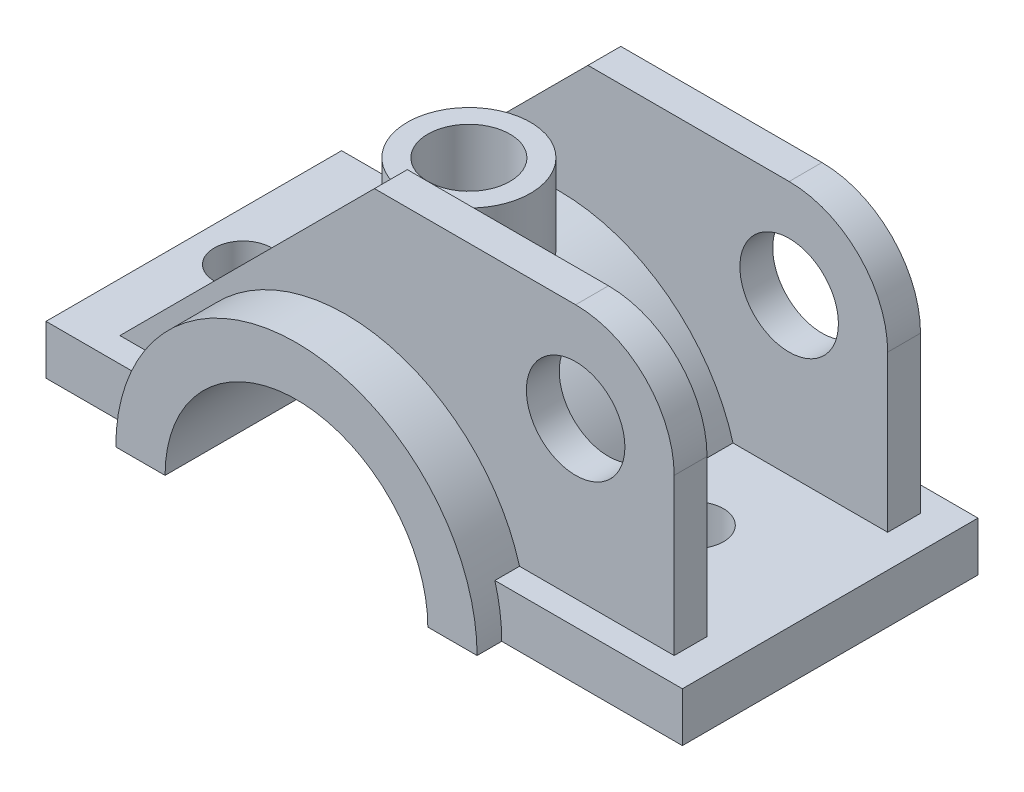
SolidWorks part; units mm, degrees
ref_plane "前视基准面" through (0, 0, 0) normal (0, 0, 1) x (1, 0, 0)
ref_plane "上视基准面" through (0, 0, 0) normal (0, 1, 0) x (1, 0, 0)
ref_plane "右视基准面" through (0, 0, 0) normal (1, 0, 0) x (0, 0, -1)
sketch "草图1" plane through (0, 0, 0) normal (0, 0, 1) x (1, 0, 0)
  line L0 (-44, 0) -> (-32, 0)
  line L1 (32, 0) -> (44, 0)
  arc A0 (32, 0) -> (-32, 0) centre (0, 0) ccw
  arc A1 (44, 0) -> (-44, 0) centre (0, 0) ccw
extrude "拉伸1" add sketch "草图1" against normal mid plane 84
ref_plane "基准面1" through (-67, 0, 0) normal (1, 0, 0) x (0, 0, -1)
sketch "草图2" plane through (-67, 0, 0) normal (1, 0, 0) x (0, 0, -1)
  line L1 (0, 0) -> (0, 59.652) construction
  line L2 (42, 0) -> (-42, 0) construction
  line L4 (-36, 12) -> (36, 12)
  line L5 (-36, 12) -> (-36, 0)
  line L6 (-36, 0) -> (36, 0)
  line L7 (36, 12) -> (36, 0)
extrude "拉伸2" add sketch "草图2" along normal up to next
ref_plane "基准面2" through (88, 0, 0) normal (1, 0, 0) x (0, 0, -1)
sketch "草图3" plane through (88, 0, 0) normal (1, 0, 0) x (0, 0, -1)
  line L1 (-36, 12) -> (36, 12)
  line L2 (-36, 12) -> (-36, 0)
  line L3 (-36, 0) -> (36, 0)
  line L4 (36, 12) -> (36, 0)
extrude "拉伸3" add sketch "草图3" against normal up to next
ref_plane "基准面3" through (0, 62, 0) normal (0, 1, 0) x (-1, 0, 0)
sketch "草图4" plane through (0, 62, 0) normal (0, 1, 0) x (-1, 0, 0)
  circle A0 centre (0, 0) radius 10
  circle A1 centre (0, 0) radius 15
extrude "拉伸4" add sketch "草图4" against normal up to next
ref_plane "基准面4" through (0, 0, 30) normal (0, 0, 1) x (1, 0, 0)
sketch "草图6" plane through (0, 0, 30) normal (0, 0, 1) x (1, 0, 0)
  line L0 (80, 12) -> (80, 50)
  line L1 (42.332, 12) -> (88, 12) construction
  line L2 (56, 74) -> (7, 74)
  line L3 (7, 74) -> (-55, 12)
  line L4 (-42.332, 12) -> (-67, 12) construction
  line L5 (-55, 12) -> (-42.332, 12)
  line L6 (80, 12) -> (42.332, 12)
  arc A0 (80, 50) -> (56, 74) centre (56, 50) ccw
  arc A1 (42.332, 12) -> (-42.332, 12) centre (0, 0) ccw
  circle A2 centre (56, 50) radius 12
  dimension "D3" = 24
  dimension "D1" = 8
  dimension "D2" = 38
  dimension "D4" = 45
  dimension "D5" = 12
extrude "拉伸6" add sketch "草图6" against normal blind 8
mirror "镜向2" about plane through (0, 0, 0) normal (0, 0, 1) of "拉伸6"
sketch "草图7" plane through (0, 12, 0) normal (0, 1, 0) x (1, 0, 0)
  line L0 (-55, 22) -> (-55, -22) construction
  line L1 (-55, 0) -> (55, 0) construction
  circle A0 centre (-55, 0) radius 7
  circle A1 centre (55, 0) radius 7
extrude "切除-拉伸1" cut sketch "草图7" against normal through all
sketch "草图8" plane through (0, 62, 0) normal (0, 1, 0) x (1, 0, 0)
  circle A0 centre (0, 0) radius 10
extrude "切除-拉伸2" cut sketch "草图8" against normal through all
